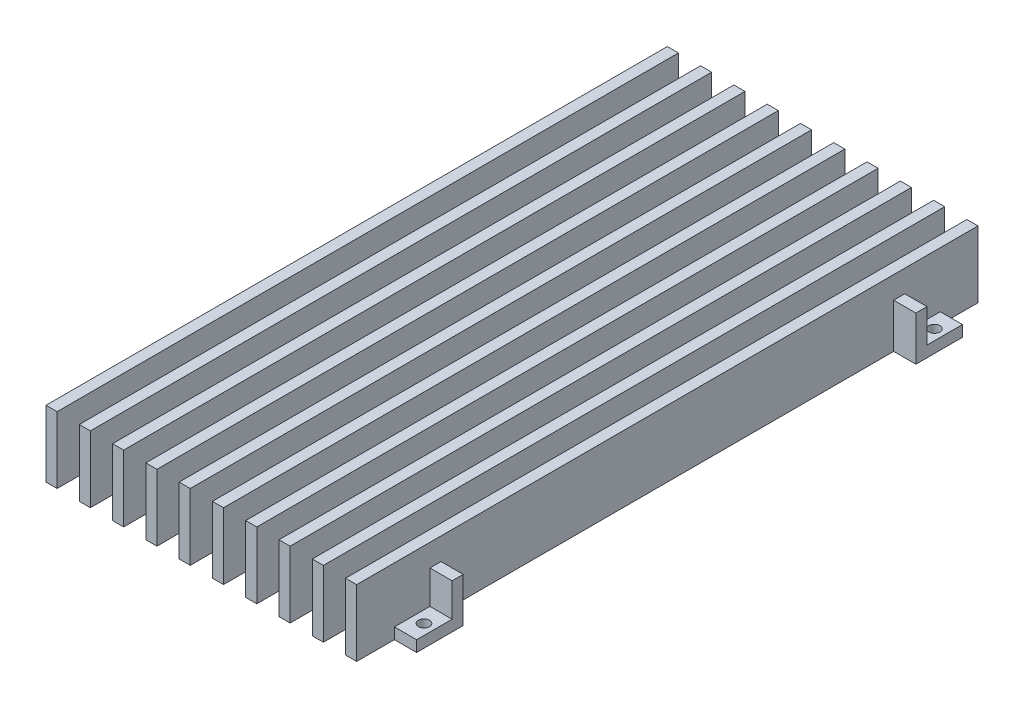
SolidWorks part; units mm, degrees
ref_plane "Front Plane" through (0, 0, 0) normal (0, 0, 1) x (1, 0, 0)
ref_plane "Top Plane" through (0, 0, 0) normal (0, 1, 0) x (1, 0, 0)
ref_plane "Right Plane" through (0, 0, 0) normal (1, 0, 0) x (0, 0, -1)
sketch "Sketch1" plane through (0, 0, 0) normal (0, 0, 1) x (1, 0, 0)
  line L1 (1.5875, -9.525) -> (-1.5875, -9.525)
  line L2 (1.5875, -9.525) -> (1.5875, 9.525)
  line L3 (1.5875, 9.525) -> (-1.5875, 9.525)
  line L4 (-1.5875, -9.525) -> (-1.5875, 9.525)
  line L5 (1.5875, -9.525) -> (-1.5875, 9.525) construction
  line L6 (1.5875, 9.525) -> (-1.5875, -9.525) construction
  point P0 (0, 0)
  dimension "D1" = 3.175
  dimension "D2" = 19.05
extrude "Boss-Extrude1" add sketch "Sketch1" against normal blind 177.8
pattern_linear "LPattern1" count 10 spacing 9.525 along (1, 0, 0)
ref_plane "Plane1" through (42.8625, 0, 0) normal (-1, 0, 0) x (0, 0, 1)
sketch "Sketch2" plane through (42.8625, 0, 0) normal (-1, 0, 0) x (0, 0, 1)
  line L0 (-177.8, -9.525) -> (0, -9.525) construction
  line L1 (-156.845, -9.525) -> (-153.67, -9.525)
  line L2 (-156.845, -9.525) -> (-156.845, 3.175)
  line L3 (-156.845, 3.175) -> (-153.67, 3.175)
  line L4 (-153.67, -9.525) -> (-153.67, 3.175)
  line L5 (-88.9, 9.525) -> (-88.9, -9.525) construction
  line L6 (-177.8, 9.525) -> (0, 9.525) construction
  line L7 (-24.13, -9.525) -> (-24.13, 3.175)
  line L8 (-20.955, 3.175) -> (-24.13, 3.175)
  line L9 (-20.955, -9.525) -> (-20.955, 3.175)
  line L10 (-20.955, -9.525) -> (-24.13, -9.525)
  dimension "D1" = 12.7
  dimension "D2" = 3.175
  dimension "D3" = 64.77
extrude "Boss-Extrude2" add sketch "Sketch2" along normal mid plane 101.6
ref_plane "Plane2" through (0, 0, -88.9) normal (0, 0, 1) x (1, 0, 0)
sketch "Sketch3" plane through (0, 0, -156.845) normal (0, 0, -1) x (-1, 0, 0)
  line L0 (7.9375, 3.175) -> (7.9375, -9.525) construction
  line L1 (1.5875, -9.525) -> (7.9375, -9.525)
  line L2 (1.5875, -9.525) -> (1.5875, -6.35)
  line L3 (1.5875, -6.35) -> (7.9375, -6.35)
  line L4 (7.9375, -9.525) -> (7.9375, -6.35)
  line L5 (-93.6625, 3.175) -> (-93.6625, -9.525) construction
  line L6 (-87.3125, -9.525) -> (-93.6625, -9.525)
  line L7 (-87.3125, -9.525) -> (-87.3125, -6.35)
  line L8 (-87.3125, -6.35) -> (-93.6625, -6.35)
  line L9 (-93.6625, -9.525) -> (-93.6625, -6.35)
  dimension "D1" = 3.175
extrude "Boss-Extrude3" add sketch "Sketch3" along normal blind 10.16
mirror "Mirror1" about plane through (0, 0, -88.9) normal (0, 0, 1) of "Boss-Extrude3"
sketch "Sketch5" plane through (0, -9.525, 0) normal (0, -1, 0) x (1, 0, 0)
  line L0 (93.6625, -167.005) -> (93.6625, -156.845) construction
  line L1 (87.3125, -167.005) -> (93.6625, -167.005) construction
  line L2 (87.3125, -10.795) -> (93.6625, -10.795) construction
  line L3 (93.6625, -10.795) -> (93.6625, -20.955) construction
  line L4 (-7.9375, -10.795) -> (-1.5875, -10.795) construction
  line L5 (-7.9375, -10.795) -> (-7.9375, -20.955) construction
  line L6 (-7.9375, -167.005) -> (-1.5875, -167.005) construction
  line L7 (-7.9375, -167.005) -> (-7.9375, -156.845) construction
  point P0 (-4.9749, -15.875)
  point P1 (90.6999, -15.875)
  point P3 (90.6999, -161.925)
  point P5 (-4.9749, -161.925)
  dimension "D1" = 2.9626
  dimension "D2" = 5.08
  dimension "D3" = 5.08
  dimension "D4" = 2.9626
  dimension "D5" = 5.08
  dimension "D6" = 2.9626
  dimension "D7" = 5.08
  dimension "D8" = 2.9626
other "AdvancedHole1" parameters "D1"=3.175
sketch3d "3DSketch1"
  point P0 (90.6999, -6.35, -161.925)
  point P1 (90.6999, -6.35, -15.875)
  point P2 (-4.9749, -6.35, -15.875)
  point P3 (-4.9749, -6.35, -161.925)
sketch "Sketch7" plane through (90.6999, -6.35, -161.925) normal (0, 0, -1) x (1, 0, 0)
  line L0 (0, 0) -> (0, 4.1289)
  line L1 (0, -0.3556) -> (0, 1.0668) construction
  line L2 (1.5875, 0) -> (1.5875, 3.175)
  line L3 (0, 0) -> (1.5875, 0)
  line L4 (1.5875, 3.175) -> (0, 4.1289)
  line L5 (-1.5875, 3.175) -> (0, 4.1289) construction
  point P7 (0, 3.175)
  dimension "D1" = 3.175
  dimension "D2" = 3.175
  dimension "D3" = 118
